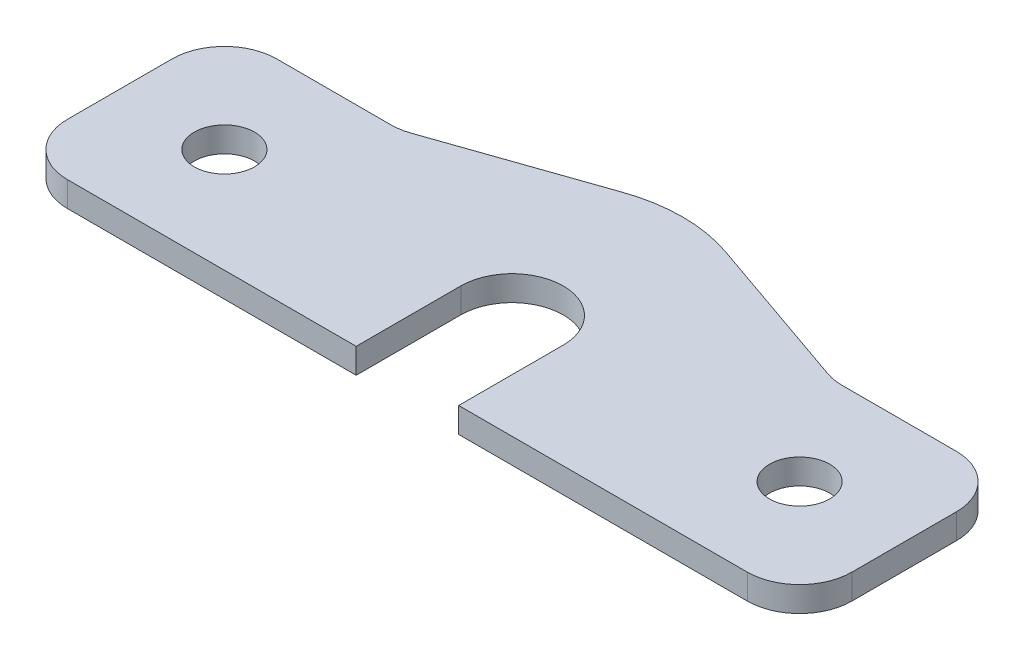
SolidWorks part; units mm, degrees
ref_plane "Front Plane" through (0, 0, 0) normal (0, 0, 1) x (1, 0, 0)
ref_plane "Top Plane" through (0, 0, 0) normal (0, 1, 0) x (1, 0, 0)
ref_plane "Right Plane" through (0, 0, 0) normal (1, 0, 0) x (0, 0, -1)
sketch "Sketch1" plane through (0, 0, 0) normal (0, 1, 0) x (1, 0, 0)
  line L0 (0, 0) -> (0, 55.5682) construction
  line L1 (0, 0) -> (54.928, 0) construction
  line L2 (-23.8125, -6.35) -> (-3.1115, -6.35)
  line L3 (-3.1115, 0) -> (-3.1115, -6.35)
  line L4 (3.1115, 0) -> (3.1115, -6.35)
  line L5 (3.1115, -6.35) -> (23.8125, -6.35)
  line L6 (23.8125, -6.35) -> (23.8125, 6.35)
  line L7 (23.8125, 6.35) -> (13.1629, 6.35)
  line L8 (13.1629, 6.35) -> (3.1248, 9.8361)
  line L9 (-13.1629, 6.35) -> (-3.1248, 9.8361)
  line L10 (-23.8125, -6.35) -> (-23.8125, 6.35)
  line L11 (-23.8125, 6.35) -> (-13.1629, 6.35)
  arc A0 (3.1115, 0) -> (-3.1115, 0) centre (0, 0) ccw
  circle A1 centre (17.4625, 0) radius 1.8288
  circle A2 centre (-17.4625, 0) radius 1.8288
  arc A3 (3.1248, 9.8361) -> (-3.1248, 9.8361) centre (0, 0.8382) ccw
  dimension "D1" = 3.6576
  dimension "D2" = 6.223
  dimension "D3" = 34.925
  dimension "D6" = 6.35
  dimension "D8" = 9.525
  dimension "D4" = 47.625
  dimension "D5" = 12.7
  dimension "D7" = 10.6496
  dimension "D9" = 16.7132
extrude "Boss-Extrude1" add sketch "Sketch1" along normal blind 1.524
fillet "Fillet1" radius 3.175 6 edges at (13.1629, 0.762, -6.35) (-13.1629, 0.762, -6.35) (-23.8125, 0.762, -6.35) (23.8125, 0.762, -6.35) (-23.8125, 0.762, 6.35) (23.8125, 0.762, 6.35)
